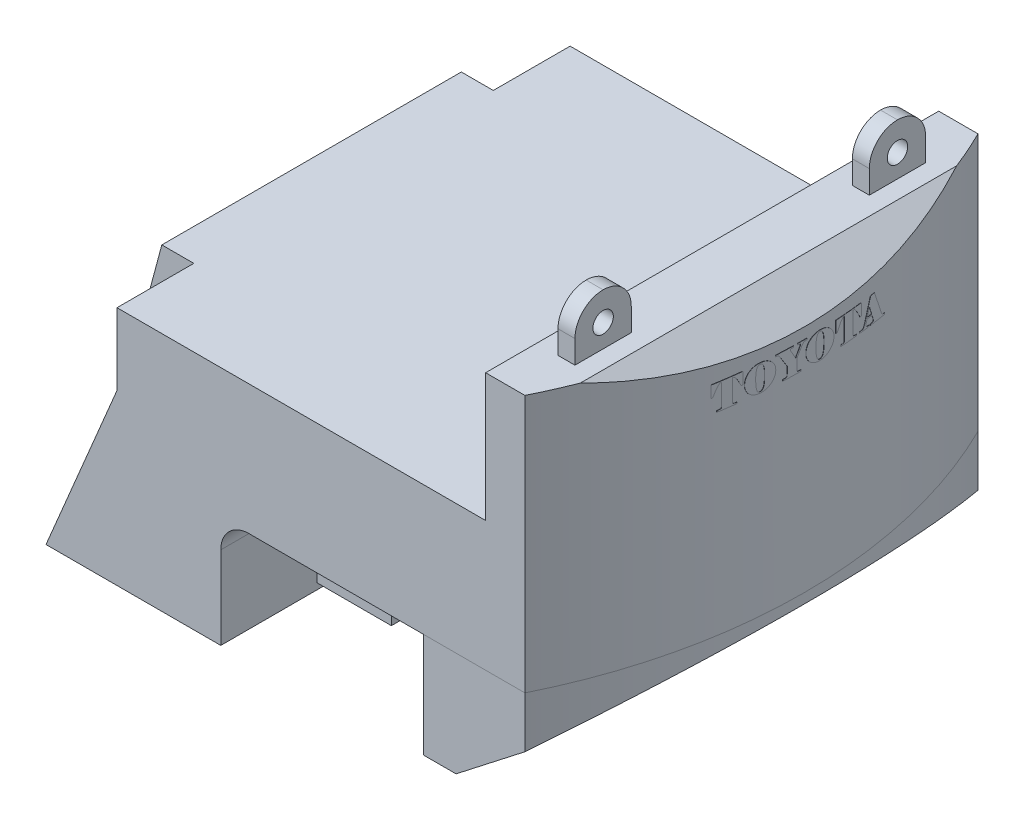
SolidWorks part; units mm, degrees
ref_plane "Front Plane" through (0, 0, 0) normal (0, 0, 1) x (1, 0, 0)
ref_plane "Top Plane" through (0, 0, 0) normal (0, 1, 0) x (1, 0, 0)
ref_plane "Right Plane" through (0, 0, 0) normal (1, 0, 0) x (0, 0, -1)
sketch "Sketch1" plane through (0, 0, 0) normal (0, 1, 0) x (1, 0, 0)
  line L0 (0, 0) -> (0, 1170)
  line L1 (0, 1170) -> (200, 1170)
  line L2 (200, 1170) -> (200, 1470)
  line L3 (200, 1470) -> (1793.537, 1470)
  line L4 (0, 0) -> (200, 0)
  line L5 (200, 0) -> (200, -300)
  line L6 (200, -300) -> (1793.537, -300)
  line L7 (0, 585) -> (2000, 585) construction
  arc A0 (2000, 585) -> (1793.537, -300) centre (0, 585) cw
  arc A1 (2000, 585) -> (1793.537, 1470) centre (0, 585) ccw
  dimension "D1" = 1170
  dimension "D2" = 200
  dimension "D3" = 300
  dimension "D4" = 2000
extrude "Boss-Extrude1" add sketch "Sketch1" along normal blind 280
sketch "Sketch3" plane through (0, 0, 0) normal (0, 0, 1) x (1, 0, 0)
  line L0 (0, 0) -> (75.0258, 280)
  line L1 (0, 280) -> (200, 280) construction
  line L2 (75.0258, 280) -> (0, 280)
  line L3 (0, 280) -> (0, 0)
  dimension "D1" = 15
extrude "Cut-Extrude1" cut sketch "Sketch3" against normal up to next
sketch "Sketch4" plane through (0, 0, 0) normal (0, -1, 0) x (1, 0, 0)
  line L0 (0, 0) -> (1912.531, 0)
  line L1 (0, -1170) -> (1912.531, -1170)
  line L9 (200, 0) -> (0, 0)
  line L10 (0, 0) -> (0, -1170)
  line L11 (0, -1170) -> (200, -1170)
  line L12 (200, -1170) -> (200, -1470)
  line L13 (200, -1470) -> (1793.537, -1470)
  line L14 (1793.537, 300) -> (200, 300)
  line L15 (200, 300) -> (200, 0)
  line L17 (0, 0) -> (0, -1170)
  arc A0 (1793.537, -1470) -> (1793.537, 300) centre (0, -585) ccw construction
  arc A1 (1912.531, -1170) -> (1912.531, 0) centre (0, -585) ccw
  arc A2 (1793.537, -1470) -> (1793.537, 300) centre (0, -585) ccw
  dimension "D1" = 0
extrude "Boss-Extrude2" add sketch "Sketch4" along normal blind 385
sketch "Sketch5" plane through (0, 0, 0) normal (0, 0, 1) x (1, 0, 0)
  line L0 (0, -385) -> (0, 0)
  line L1 (0, 0) -> (-103.1604, -385)
  line L2 (-103.1604, -385) -> (0, -385)
  line L3 (0, 0) -> (75.0258, 280) construction
extrude "Boss-Extrude3" add sketch "Sketch5" against normal up to surface (1170 mm away)
sketch "Sketch6" plane through (0, -385, 0) normal (0, -1, 0) x (1, 0, 0)
  line L0 (-103.1604, -1170) -> (-103.1604, 0) construction
  line L1 (-103.1604, -1095) -> (896.8396, -1095)
  line L2 (-103.1604, -1095) -> (-103.1604, -75)
  line L3 (-103.1604, -75) -> (896.8396, -75)
  line L4 (896.8396, -1095) -> (896.8396, -75)
  line L5 (-103.1604, -1170) -> (1912.531, -1170) construction
  line L6 (1912.531, 0) -> (1524.5231, 0)
  line L7 (1524.5231, -1170) -> (1396.8396, -949)
  line L8 (1396.8396, -949) -> (1396.8396, -221)
  line L9 (1396.8396, -221) -> (1524.5231, 0)
  line L10 (1912.531, 0) -> (200, 0) construction
  line L11 (1912.531, -1170) -> (1524.5231, -1170)
  line L12 (896.8396, -585) -> (1860, -585) construction
  line L13 (1912.531, 0) -> (-103.1604, 0) construction
  line L16 (1912.531, 0) -> (-103.1604, 0)
  line L17 (-103.1604, 0) -> (-103.1604, -1170)
  line L18 (-103.1604, -1170) -> (1912.531, -1170)
  line L19 (1912.531, 0) -> (1524.5231, 0)
  line L20 (-103.1604, -75) -> (-103.1604, -1095)
  line L21 (1524.5231, -1170) -> (1912.531, -1170)
  arc A1 (1912.531, -1170) -> (1912.531, 0) centre (0, -585) ccw
  arc A3 (1912.531, -1170) -> (1912.531, 0) centre (0, -585) ccw construction
  arc A4 (1912.531, -1170) -> (1912.531, 0) centre (0, -585) ccw
  dimension "D1" = 75
  dimension "D2" = 75
  dimension "D3" = 1000
  dimension "D4" = 728
  dimension "D5" = 0
  dimension "D6" = 500
extrude "Boss-Extrude5" add sketch "Sketch6" along normal blind 250
sketch "Sketch8" plane through (0, 0, 0) normal (0, -1, 0) x (1, 0, 0)
  line L3 (200, 0) -> (1912.531, 0)
  line L4 (1793.537, 300) -> (200, 300)
  line L5 (200, 300) -> (200, 0)
  line L6 (200, 0) -> (1912.531, 0)
  line L7 (1793.537, 300) -> (200, 300)
  line L8 (200, 300) -> (200, 0)
  arc A1 (1912.531, 0) -> (1793.537, 300) centre (0, -585) ccw
  arc A2 (1912.531, 0) -> (1793.537, 300) centre (0, -585) ccw
  dimension "D1" = 0
extrude "Boss-Extrude6" [suppressed] add sketch "Sketch8" along normal up to surface (385 mm away)
sketch "Sketch9" plane through (0, 0, 0) normal (0, -1, 0) x (1, 0, 0)
  line L3 (1912.531, -1170) -> (200, -1170)
  line L4 (200, -1170) -> (200, -1470)
  line L5 (200, -1470) -> (1793.537, -1470)
  line L6 (1912.531, -1170) -> (200, -1170)
  line L7 (200, -1170) -> (200, -1470)
  line L8 (200, -1470) -> (1793.537, -1470)
  arc A1 (1793.537, -1470) -> (1912.531, -1170) centre (0, -585) ccw
  arc A2 (1793.537, -1470) -> (1912.531, -1170) centre (0, -585) ccw
  dimension "D1" = 0
extrude "Boss-Extrude7" [suppressed] add sketch "Sketch9" along normal up to surface (385 mm away)
sketch "Sketch10" plane through (0, -385, 0) normal (0, -1, 0) x (1, 0, 0)
  line L0 (1524.5231, -1170) -> (1524.5231, -1470)
  line L1 (1524.5231, -1470) -> (1793.537, -1470)
  line L2 (1524.5231, 0) -> (1524.5231, -1170)
  line L3 (1524.5231, -1170) -> (1912.531, -1170)
  line L16 (1396.8396, -221) -> (1524.5231, 0)
  line L17 (1524.5231, 0) -> (-103.1604, 0)
  line L21 (-103.1604, 0) -> (-103.1604, -75)
  line L22 (-103.1604, -75) -> (896.8396, -75)
  line L23 (896.8396, -75) -> (896.8396, -1095)
  line L24 (896.8396, -1095) -> (-103.1604, -1095)
  line L25 (-103.1604, -1095) -> (-103.1604, -1170)
  line L26 (-103.1604, -1170) -> (1524.5231, -1170)
  line L30 (1524.5231, -1170) -> (1396.8396, -949)
  line L31 (1396.8396, -949) -> (1396.8396, -221)
  line L32 (1396.8396, -221) -> (1524.5231, 0)
  line L33 (1524.5231, 0) -> (-103.1604, 0)
  line L37 (-103.1604, 0) -> (-103.1604, -75)
  line L38 (-103.1604, -75) -> (896.8396, -75)
  line L39 (896.8396, -75) -> (896.8396, -1095)
  line L40 (896.8396, -1095) -> (-103.1604, -1095)
  line L41 (-103.1604, -1095) -> (-103.1604, -1170)
  line L42 (-103.1604, -1170) -> (1524.5231, -1170)
  line L46 (1524.5231, -1170) -> (1396.8396, -949)
  line L47 (1396.8396, -949) -> (1396.8396, -221)
  dimension "D1" = 0
extrude "Boss-Extrude8" add sketch "Sketch10" along normal up to surface (250 mm away)
sketch "Sketch11" plane through (0, -385, 0) normal (0, -1, 0) x (1, 0, 0)
  line L10 (1396.8396, -221) -> (1524.5231, 0)
  line L11 (1524.5231, 0) -> (-103.1604, 0)
  line L12 (-103.1604, 0) -> (-103.1604, -75)
  line L13 (-103.1604, -75) -> (896.8396, -75)
  line L14 (896.8396, -75) -> (896.8396, -1095)
  line L15 (896.8396, -1095) -> (-103.1604, -1095)
  line L16 (-103.1604, -1095) -> (-103.1604, -1170)
  line L17 (-103.1604, -1170) -> (1524.5231, -1170)
  line L18 (1524.5231, -1170) -> (1396.8396, -949)
  line L19 (1396.8396, -949) -> (1396.8396, -221)
  line L20 (1396.8396, -221) -> (1524.5231, 0)
  line L21 (1524.5231, 0) -> (-103.1604, 0)
  line L22 (-103.1604, 0) -> (-103.1604, -75)
  line L23 (-103.1604, -75) -> (896.8396, -75)
  line L24 (896.8396, -75) -> (896.8396, -1095)
  line L25 (896.8396, -1095) -> (-103.1604, -1095)
  line L26 (-103.1604, -1095) -> (-103.1604, -1170)
  line L27 (-103.1604, -1170) -> (1524.5231, -1170)
  line L28 (1524.5231, -1170) -> (1396.8396, -949)
  line L29 (1396.8396, -949) -> (1396.8396, -221)
  dimension "D1" = 0
extrude "Boss-Extrude9" add sketch "Sketch11" along normal blind 95
sketch "Sketch12" plane through (0, 280, 0) normal (0, 1, 0) x (1, 0, 0)
  line L0 (1640, 1470) -> (1640, -300)
  line L7 (200, 1170) -> (75.0258, 1170)
  line L8 (75.0258, 1170) -> (75.0258, 0)
  line L9 (75.0258, 0) -> (200, 0)
  line L10 (200, 0) -> (200, -300)
  line L11 (200, -300) -> (1793.537, -300)
  line L12 (1793.537, 1470) -> (200, 1470)
  line L13 (200, 1470) -> (200, 1170)
  line L14 (200, 1170) -> (75.0258, 1170)
  line L15 (75.0258, 1170) -> (75.0258, 0)
  line L16 (75.0258, 0) -> (200, 0)
  line L17 (200, 0) -> (200, -300)
  line L18 (1640, -300) -> (1793.537, -300)
  line L19 (1793.537, 1470) -> (1640, 1470)
  line L20 (200, 1470) -> (200, 1170)
  arc A1 (1793.537, -300) -> (1793.537, 1470) centre (0, 585) ccw
  arc A2 (1793.537, -300) -> (1793.537, 1470) centre (0, 585) ccw
  dimension "D2" = 1440
  dimension "D1" = 0
extrude "Boss-Extrude10" add sketch "Sketch12" along normal blind 500 contours L0 M15 M13 M14
sketch "Sketch15" plane through (0, 0, 300) normal (0, 0, 1) x (1, 0, 0)
  line L0 (1860, 780) -> (2046.7437, 636.3691)
  line L1 (2000, 780) -> (1793.537, 780) construction
  line L2 (2046.7437, 636.3691) -> (2046.7437, 829.5833)
  line L3 (2046.7437, 829.5833) -> (1860, 829.5833)
  line L4 (1860, 829.5833) -> (1860, 780)
  line L5 (1860, 780) -> (1857.5748, 777.0332)
  dimension "D1" = 140
extrude "Cut-Extrude2" cut sketch "Sketch15" against normal through all contours L3 L4 L0 L2
sketch "Sketch16" plane through (0, 0, 300) normal (0, 0, 1) x (1, 0, 0)
  line L0 (2000, -265) -> (1524.5231, -635)
  line L1 (2000, -635) -> (2000, 672.3213) construction
  line L2 (2000, -265) -> (2161.6477, -265)
  line L3 (2161.6477, -265) -> (2161.6477, -750.3485)
  line L4 (1524.5231, -635) -> (1524.5231, -750.3485)
  line L5 (1524.5231, -750.3485) -> (2161.6477, -750.3485)
  line L6 (1912.531, -635) -> (1524.5231, -635) construction
  dimension "D1" = 370
extrude "Cut-Extrude3" cut sketch "Sketch16" against normal through all
sketch "Sketch17" plane through (0, 780, 0) normal (0, 1, 0) x (1, 0, 0)
  line L0 (1640, -300) -> (1793.537, -300) construction
  line L1 (1722.7561, 120) -> (1788.9387, 120)
  line L2 (1722.7561, 120) -> (1722.7561, -100)
  line L3 (1722.7561, -100) -> (1788.9387, -100)
  line L4 (1788.9387, 120) -> (1788.9387, -100)
  line L5 (1640, 585) -> (1788.9387, 585) construction
  line L6 (1640, 1470) -> (1640, -300) construction
  line L7 (1788.9387, 1050) -> (1788.9387, 1270)
  line L8 (1722.7561, 1270) -> (1788.9387, 1270)
  line L9 (1722.7561, 1050) -> (1722.7561, 1270)
  line L10 (1722.7561, 1050) -> (1788.9387, 1050)
  dimension "D1" = 200
  dimension "D2" = 220
extrude "Boss-Extrude11" add sketch "Sketch17" along normal blind 200
fillet "Fillet1" radius 110 4 edges at (1755.8474, 980, -1270) (1755.8474, 980, -1050) (1755.8474, 980, -120) (1755.8474, 980, 100)
sketch "Sketch18" plane through (1788.9387, 0, 0) normal (1, 0, 0) x (0, 0, -1)
  circle A0 centre (10, 870) radius 40
extrude "Cut-Extrude4" cut sketch "Sketch18" against normal up to next
sketch "Sketch19" plane through (1788.9387, 0, 0) normal (1, 0, 0) x (0, 0, -1)
  circle A0 centre (1160, 870) radius 40
extrude "Cut-Extrude5" cut sketch "Sketch19" against normal up to next
sketch "Sketch20" plane through (0, 0, 300) normal (0, 0, 1) x (1, 0, 0)
  line L0 (200, 0) -> (-77.4385, -660)
  line L1 (1912.531, 0) -> (200, 0) construction
  line L2 (1912.531, -333.0654) -> (1912.531, 0) construction
  line L3 (1524.5231, -635) -> (1912.531, -333.0654) construction
  line L4 (1396.8396, -635) -> (1524.5231, -635) construction
  line L5 (1912.531, 0) -> (200, 0)
  line L6 (1912.531, -333.0654) -> (1912.531, 0)
  line L7 (1524.5231, -635) -> (1912.531, -333.0654)
  line L8 (1396.8396, -635) -> (1524.5231, -635)
  line L9 (-77.4385, -660) -> (605.4115, -660)
  line L10 (605.4115, -660) -> (605.4115, -226.51)
  line L11 (605.4115, -226.51) -> (1396.8396, -226.51)
  line L12 (1396.8396, -226.51) -> (1396.8396, -635)
  dimension "D1" = 112.8
  dimension "D2" = 660
  dimension "D3" = 682.85
  dimension "433.49" = 433.49
extrude "Boss-Extrude12" add sketch "Sketch20" against normal up to surface (1470 mm away)
sketch "Sketch21" plane through (0, 0, 0) normal (0, 1, 0) x (1, 0, 0)
  line L2 (1793.537, -300) -> (1912.531, -300)
  line L3 (1912.531, -300) -> (1912.531, 0)
  line L4 (1793.537, -300) -> (1912.531, -300)
  line L5 (1912.531, -300) -> (1912.531, 0)
  arc A1 (1793.537, -300) -> (1912.531, 0) centre (0, 585) ccw
  arc A2 (1793.537, -300) -> (1912.531, 0) centre (0, 585) ccw
  dimension "D1" = 0
extrude "Cut-Extrude6" cut sketch "Sketch21" against normal through all
ref_plane "Plane1" through (0, 0, -585) normal (0, 0, 1) x (1, 0, 0)
mirror "Mirror1" about plane through (0, 0, -585) normal (0, 0, 1) of "Boss-Extrude12"
sketch "Sketch22" plane through (0, 0, 0) normal (0, 1, 0) x (1, 0, 0)
  line L2 (1912.531, 1470) -> (1793.537, 1470)
  line L3 (1912.531, 1170) -> (1912.531, 1470)
  line L4 (1912.531, 1470) -> (1793.537, 1470)
  line L5 (1912.531, 1170) -> (1912.531, 1470)
  arc A1 (1912.531, 1170) -> (1793.537, 1470) centre (0, 585) ccw
  arc A2 (1912.531, 1170) -> (1793.537, 1470) centre (0, 585) ccw
  dimension "D1" = 0
extrude "Cut-Extrude7" cut sketch "Sketch22" against normal through all
fillet "Fillet2" radius 110 1 edges at (605.4115, -226.51, 150)
fillet "Fillet3" radius 110 1 edges at (605.4115, -226.51, -1320)
sketch "Sketch23" plane through (0, 0, -585) normal (0, 0, 1) x (1, 0, 0)
  line L0 (1396.8396, -226.51) -> (2000, -226.51)
  line L1 (2000, -265) -> (2000, 672.3213) construction
ref_plane "Plane2" through (2096.8396, 0, 0) normal (-1, 0, 0) x (0, 0, 1)
sketch "Sketch24" plane through (2096.8396, 0, 0) normal (-1, 0, 0) x (0, 0, 1)
  line L0 (300, 530) -> (-1470, 530) construction
  line L1 (300, 780) -> (300, -226.51) construction
  line L2 (-1470, 780) -> (-1470, -226.51) construction
  text T0 "TOYOTA" font "Elephant" height 100
  dimension "D1" = 250
wrap "Wrap2" sketch "Sketch24" wrap type emboss source sketch "Sketch24" thickness 1 parameters "D1"=1
